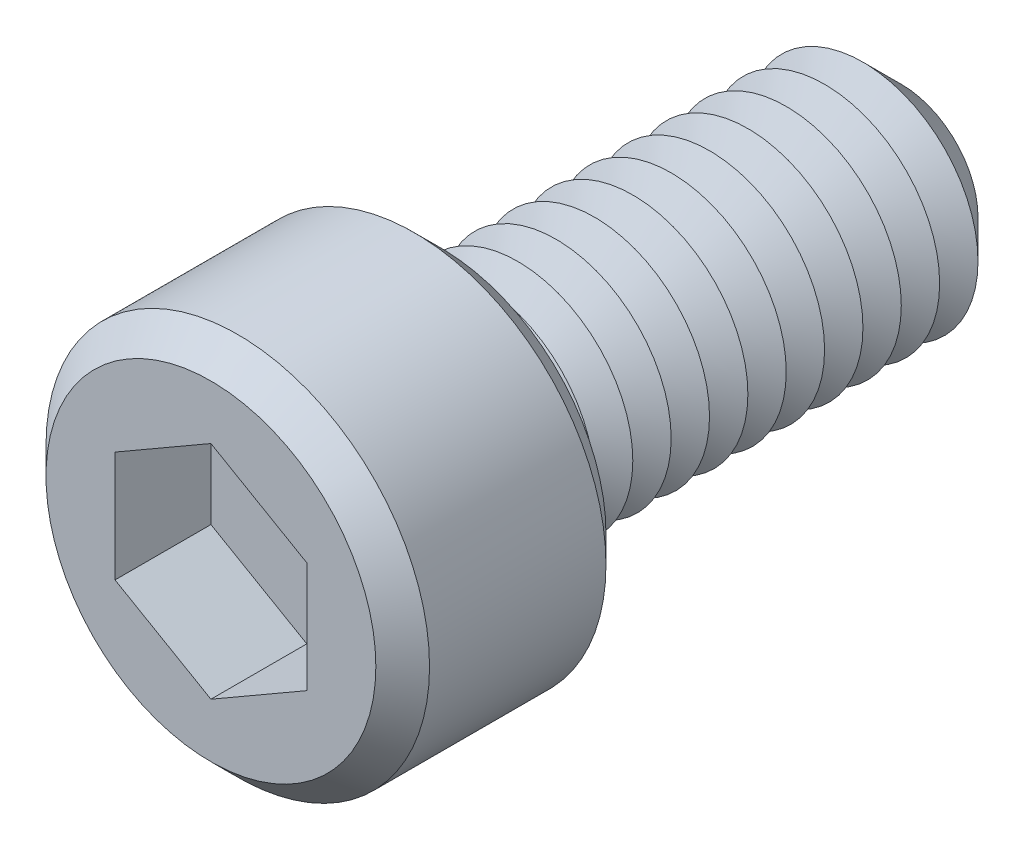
SolidWorks part; units mm, degrees
ref_plane "Front Plane" through (0, 0, 0) normal (0, 0, 1) x (1, 0, 0)
ref_plane "Top Plane" through (0, 0, 0) normal (0, 1, 0) x (1, 0, 0)
ref_plane "Right Plane" through (0, 0, 0) normal (1, 0, 0) x (0, 0, -1)
sketch "Sketch1" plane through (0, 0, 0) normal (0, 0, 1) x (1, 0, 0)
  circle A0 centre (0, 0) radius 5
  dimension "D1" = 10
extrude "Boss-Extrude1" add sketch "Sketch1" along normal blind 6
sketch "Sketch2" plane through (0, 0, 0) normal (0, 0, -1) x (-1, 0, 0)
  circle A0 centre (0, 0) radius 3
  dimension "D1" = 6
extrude "Boss-Extrude2" add sketch "Sketch2" along normal blind 12
chamfer "Chamfer1" distance 1 angle 45 1 edges at (-3, 0, -12)
sketch "Sketch3" plane through (0, 0, 0) normal (1, 0, 0) x (0, 0, -1)
  line L0 (-2.5121, 0) -> (4.5776, 0) construction
sketch "Sketch4" plane through (0, 0, 0) normal (1, 0, 0) x (0, 0, -1)
  line L0 (0, 3) -> (0.5, 2.134)
  line L1 (0.5, 2.134) -> (1, 3)
  line L2 (11, 3) -> (0, 3) construction
  line L3 (1, 3) -> (0, 3)
  dimension "D1" = 1
revolve "Cut-Revolve1" cut sketch "Sketch4" angle 360 about L0
pattern_linear "LPattern1" count 11 spacing 1 along (0, 0, -1) of "Cut-Revolve1"
sketch "Sketch5" plane through (0, 0, 6) normal (0, 0, 1) x (1, 0, 0)
  line L1 (0, 2.8868) -> (-2.5, 1.4434)
  line L2 (-2.5, 1.4434) -> (-2.5, -1.4434)
  line L3 (-2.5, -1.4434) -> (0, -2.8868)
  line L4 (0, -2.8868) -> (2.5, -1.4434)
  line L5 (2.5, -1.4434) -> (2.5, 1.4434)
  line L6 (2.5, 1.4434) -> (0, 2.8868)
  circle A0 centre (0, 0) radius 2.5 construction
  dimension "D1" = 5
extrude "Cut-Extrude1" cut sketch "Sketch5" against normal blind 2.5
sketch "Sketch6" plane through (0, 0, 3.5) normal (0, 0, 1) x (1, 0, 0)
  circle A0 centre (0, 0) radius 0.8
  dimension "D1" = 1.6
extrude "Cut-Extrude2" cut sketch "Sketch6" against normal up to surface (15.5 mm away)
chamfer "Chamfer2" distance 0.7 angle 45 2 edges at (5, 0, 0) (5, 0, 6)
